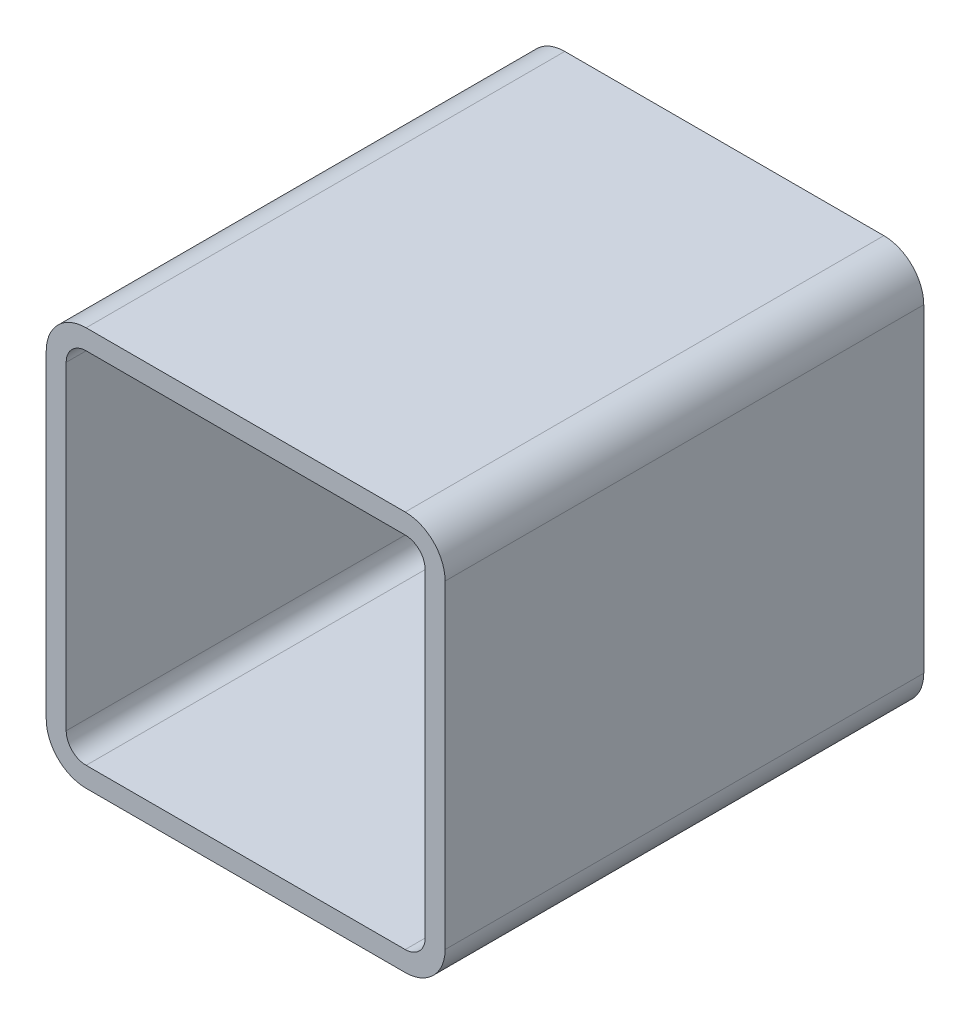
SolidWorks part; units mm, degrees
ref_plane "Front Plane" through (0, 0, 0) normal (0, 0, 1) x (1, 0, 0)
ref_plane "Top Plane" through (0, 0, 0) normal (0, 1, 0) x (1, 0, 0)
ref_plane "Right Plane" through (0, 0, 0) normal (1, 0, 0) x (0, 0, -1)
sketch "Sketch1" plane through (0, 0, 0) normal (0, 0, 1) x (1, 0, 0)
sketch_block_instance "HSS10x10x0.500-1"
sketch_block "HSS10x10x0.500"
extrude "Boss-Extrude1" add sketch "Sketch1" along normal blind 304.8
